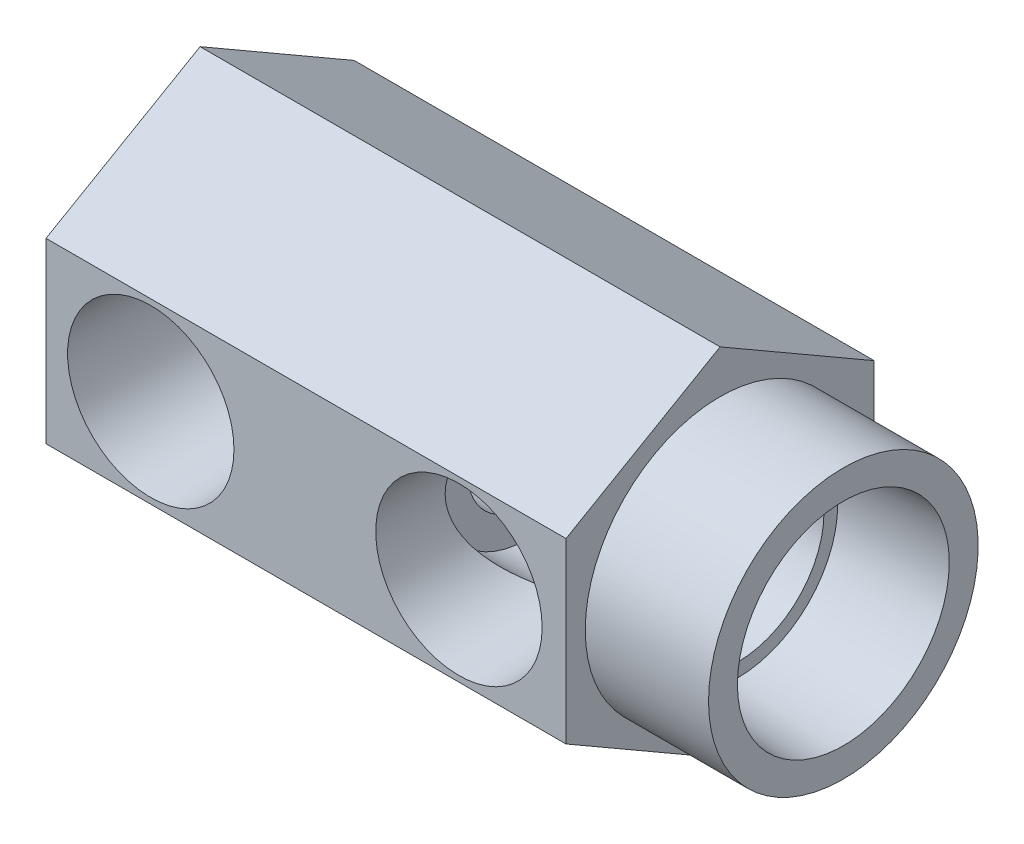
SolidWorks part; units mm, degrees
ref_plane "Front Plane" through (0, 0, 0) normal (0, 0, 1) x (1, 0, 0)
ref_plane "Top Plane" through (0, 0, 0) normal (0, 1, 0) x (1, 0, 0)
ref_plane "Right Plane" through (0, 0, 0) normal (1, 0, 0) x (0, 0, -1)
sketch "Sketch1" plane through (0, 0, 0) normal (1, 0, 0) x (0, 0, -1)
  line L0 (0, 16.1312) -> (0, -16.1312) construction
  line L1 (12.7, 7.3323) -> (0, 14.6647)
  line L2 (0, 14.6647) -> (-12.7, 7.3323)
  line L3 (-12.7, 7.3323) -> (-12.7, -7.3323)
  line L4 (-12.7, -7.3323) -> (0, -14.6647)
  line L5 (0, -14.6647) -> (12.7, -7.3323)
  line L6 (12.7, -7.3323) -> (12.7, 7.3323)
  circle A0 centre (0, 0) radius 12.7 construction
  dimension "D1" = 25.4
extrude "Boss-Extrude1" add sketch "Sketch1" along normal blind 42.8625 separate body
sketch "Sketch2" plane through (0, 0, 0) normal (-1, 0, 0) x (0, 0, 1)
  circle A1 centre (0, 0) radius 11.1125
  dimension "D1" = 22.225
extrude "Boss-Extrude2" add sketch "Sketch2" against normal blind 53.0225
sketch "Sketch3" plane through (0, 0, 0) normal (0, 1, 0) x (1, 0, 0)
  line L2 (44.2849, 7.1437) -> (44.2849, 8.2733)
  line L3 (44.2849, 7.1437) -> (26.8287, 7.1437)
  line L4 (26.8287, 7.1437) -> (26.8287, 0)
  line L5 (53.0225, -11.1125) -> (53.0225, 11.1125) construction
  line L6 (53.0225, 0) -> (53.0225, 8.7313)
  line L7 (44.2849, 8.2733) -> (53.0225, 8.7313)
  line L8 (0, 0) -> (50000, 0) construction
  line L9 (26.8287, 0) -> (53.0225, 0)
  dimension "D1" = 3
  dimension "D2" = 17.4625
  dimension "D3" = 8.7376
  dimension "D4" = 14.2875
  dimension "D5" = 26.1937
revolve "Cut-Revolve1" cut sketch "Sketch3" angle 360 about L8
hole_wizard "1/4 NPT Tapped Hole1" positions "Sketch5" profile "Sketch4" size "1/4" standard "Ansi Inch"
sketch "Sketch5" plane through (0, 0, 12.7) normal (0, 0, 1) x (1, 0, 0)
  line L0 (13.97, 0) -> (-13.97, 0) construction
  line L1 (0, -13.97) -> (0, 13.97) construction
  point P0 (8.636, 0)
  point P1 (34.036, 0)
  dimension "D1" = 8.636
  dimension "D2" = 25.4
sketch "Sketch4" plane through (8.636, 0, 12.7) normal (1, 0, 0) x (0, -1, 0)
  line L0 (0, 0) -> (0, 19.2173)
  line L1 (5.5626, 15.875) -> (0, 19.2173)
  line L2 (-5.5626, 15.875) -> (0, 19.2173) construction
  line L3 (5.5626, 15.875) -> (5.5626, 10.0203)
  line L4 (5.5626, 10.0203) -> (6.558, 10.0203)
  line L5 (6.558, 10.0203) -> (6.858, 0)
  line L6 (-6.558, 10.0203) -> (-6.858, 0) construction
  line L7 (6.858, 0) -> (0, 0)
  line L8 (0, -6.35) -> (0, 107.95) construction
  line L11 (-5.5626, 10.0203) -> (-6.558, 10.0203) construction
  dimension "Tap Drill Dia." = 11.1252
  dimension "Tap Drill Depth" = 15.875
  dimension "Thread Dia." = 13.716
  dimension "Thread Angle" = 3.43
  dimension "Thread Depth" = 10.0203
  dimension "Drill Angle" = 118
hole_wizard "1/4 NPT Tapped Hole2" positions "Sketch7" profile "Sketch6" size "1/4" standard "Ansi Inch"
sketch "Sketch7" plane through (0, 0, -12.7) normal (0, 0, -1) x (-1, 0, 0)
  circle A0 centre (-8.636, 0) radius 6.858 construction
  point P0 (-8.636, 0)
sketch "Sketch6" plane through (8.636, 0, -12.7) normal (1, 0, 0) x (0, 1, 0)
  line L0 (0, 0) -> (0, 20.4111)
  line L1 (5.5626, 17.0688) -> (0, 20.4111)
  line L2 (-5.5626, 17.0688) -> (0, 20.4111) construction
  line L3 (5.5626, 17.0688) -> (5.5626, 10.0203)
  line L4 (5.5626, 10.0203) -> (6.558, 10.0203)
  line L5 (6.558, 10.0203) -> (6.858, 0)
  line L6 (-6.558, 10.0203) -> (-6.858, 0) construction
  line L7 (6.858, 0) -> (0, 0)
  line L8 (0, -6.35) -> (0, 107.95) construction
  line L11 (-5.5626, 10.0203) -> (-6.558, 10.0203) construction
  dimension "Tap Drill Dia." = 11.1252
  dimension "Tap Drill Depth" = 17.0688
  dimension "Thread Dia." = 13.716
  dimension "Thread Angle" = 3.43
  dimension "Thread Depth" = 10.0203
  dimension "Drill Angle" = 118
hole_wizard "3/8-24 Tapped Hole1" positions "Sketch9" profile "Sketch8" tap size "3/8-24" standard "ANSI Inch"
sketch "Sketch9" plane through (53.0225, 0, 0) normal (1, 0, 0) x (0, 0, -1)
  circle A0 centre (0, 0) radius 8.7313 construction
  point P0 (0, 0)
sketch "Sketch8" plane through (53.0225, 0, 0) normal (0, 1, 0) x (0, 0, -1)
  line L0 (0, 0) -> (0, 46.986)
  line L1 (0, 46.986) -> (4.2164, 44.4525)
  line L2 (4.2164, 44.4525) -> (4.2164, 36.576)
  line L3 (4.2164, 36.576) -> (4.7625, 36.576)
  line L4 (4.7625, 36.576) -> (4.7625, 0)
  line L5 (4.7625, 0) -> (0, 0)
  line L10 (0, 46.986) -> (-4.2164, 44.4525) construction
  line L11 (0, -6.35) -> (0, 107.95) construction
  dimension "Tap Drill Dia." = 8.4328
  dimension "Tap Drill Depth" = 44.4525
  dimension "Thread Major Dia." = 9.525
  dimension "Thread Depth" = 36.576
  dimension "Drill Angle" = 118
